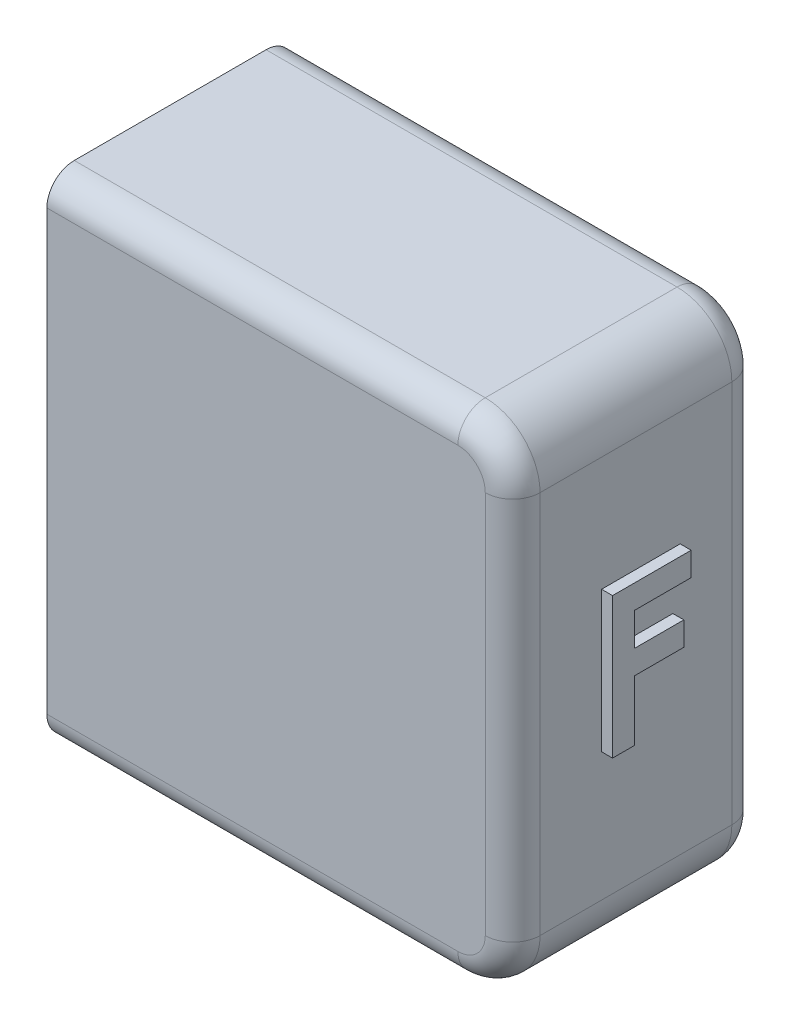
SolidWorks part; units mm, degrees
ref_plane "Front Plane" through (0, 0, 0) normal (0, 0, 1) x (1, 0, 0)
ref_plane "Top Plane" through (0, 0, 0) normal (0, 1, 0) x (1, 0, 0)
ref_plane "Right Plane" through (0, 0, 0) normal (1, 0, 0) x (0, 0, -1)
sketch "Sketch1" plane through (0, 0, 0) normal (0, 0, 1) x (1, 0, 0)
  line L1 (-8.5, -9) -> (8.5, -9)
  line L2 (-8.5, -9) -> (-8.5, 9)
  line L3 (-8.5, 9) -> (8.5, 9)
  line L4 (8.5, -9) -> (8.5, 9)
  line L5 (-8.5, -9) -> (8.5, 9) construction
  line L6 (-8.5, 9) -> (8.5, -9) construction
  point P0 (0, 0)
  dimension "D1" = 18
  dimension "D2" = 17
extrude "Boss-Extrude1" add sketch "Sketch1" along normal blind 2
sketch "Sketch3" plane through (0, 0, 2) normal (0, 0, 1) x (1, 0, 0)
  line L0 (-8.5, -9) -> (8.5, -9) construction
  line L1 (8.5, -9) -> (8.5, 9) construction
  line L2 (-8.5, 9) -> (-8.5, -9) construction
  line L3 (8.5, 9) -> (-8.5, 9) construction
  line L4 (-8.5, -9) -> (8.5, -9)
  line L5 (8.5, -9) -> (8.5, 9)
  line L6 (-8.5, 9) -> (-8.5, 6.2)
  line L7 (8.5, 9) -> (-8.5, 9)
  line L8 (5.5, 7) -> (-5.5, 7)
  line L9 (-5.5, 7) -> (-5.5, 6.2)
  line L10 (-5.5, -7) -> (5.5, -7)
  line L11 (5.5, -7) -> (5.5, 7)
  line L12 (-5.5, 6.2) -> (-8.5, 6.2)
  line L13 (-5.5, -6.2) -> (-8.5, -6.2)
  line L14 (8.5, 0) -> (5.5, 0) construction
  line L15 (-5.5, -6.2) -> (-5.5, -7)
  line L16 (-8.5, -6.2) -> (-8.5, -9)
  dimension "D2" = 3
  dimension "D1" = 3
  dimension "D3" = 6.2
  dimension "D4" = 6.2
extrude "Boss-Extrude2" add sketch "Sketch3" along normal blind 5
sketch "Sketch12" plane through (-5.5, 0, 0) normal (1, 0, 0) x (0, 0, -1)
  line L0 (-7, -6.2) -> (-2, -6.2) construction
  line L1 (-3.5, -6.2) -> (-5.5, -6.2)
  line L2 (-3.5, -6.2) -> (-3.5, -7)
  line L3 (-3.5, -7) -> (-5.5, -7)
  line L4 (-5.5, -6.2) -> (-5.5, -7)
  line L5 (-7, -7) -> (-2, -7) construction
  line L6 (-2, -7) -> (-2, -6.2) construction
  line L8 (-7, 6.2) -> (-2, 6.2) construction
  line L9 (-3.5, 6.2) -> (-5.5, 6.2)
  line L10 (-3.5, 6.2) -> (-3.5, 7)
  line L11 (-3.5, 7) -> (-5.5, 7)
  line L12 (-5.5, 6.2) -> (-5.5, 7)
  line L13 (-7, 7) -> (-2, 7) construction
  line L15 (-2, 6.2) -> (-2, 7) construction
  dimension "D1" = 2
  dimension "D2" = 1.5
  dimension "D3" = 2
  dimension "D4" = 1.5
extrude "Boss-Extrude6" add sketch "Sketch12" along normal up to next
sketch "Sketch6" plane through (0, 0, 7) normal (0, 0, 1) x (1, 0, 0)
  line L1 (-8.5, 9) -> (8.5, 9)
  line L2 (-8.5, 9) -> (-8.5, -9)
  line L3 (-8.5, -9) -> (8.5, -9)
  line L4 (8.5, 9) -> (8.5, -9)
extrude "Boss-Extrude4" add sketch "Sketch6" along normal blind 2
fillet "Fillet4" radius 2 2 edges at (8.5, -9, 4.5) (8.5, 9, 4.5)
fillet "Fillet6" radius 1 10 edges at (-1, -9, 9) (7.9142, -8.4142, 9) (-1, 9, 9) (7.9142, 8.4142, 9) (8.5, 0, 9) (-1, -9, 0) (7.9142, -8.4142, 0) (-1, 9, 0) (7.9142, 8.4142, 0) (8.5, 0, 0)
sketch "Sketch13" plane through (8.5, 0, 0) normal (1, 0, 0) x (0, 0, -1)
  text T0 "<b>F</b>" font "Arial Narrow" height in points 20
extrude "Boss-Extrude7" add sketch "Sketch13" along normal blind 0.4
